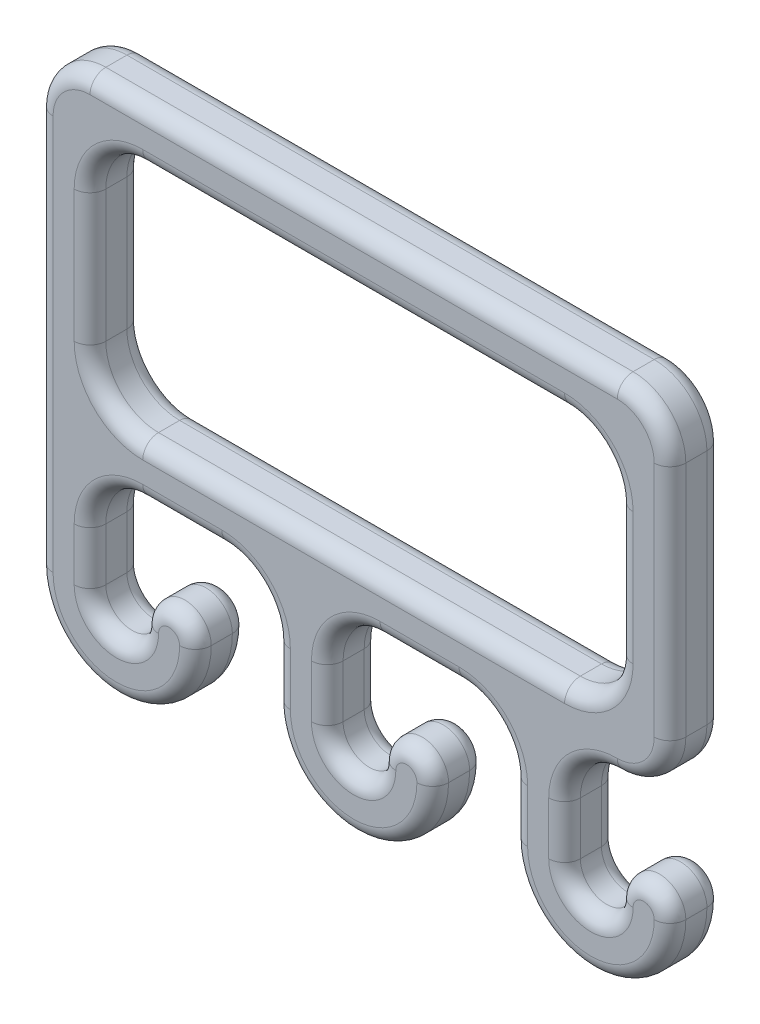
SolidWorks part; units mm, degrees
ref_plane "Plano frontal" through (0, 0, 0) normal (0, 0, 1) x (1, 0, 0)
ref_plane "Plano superior" through (0, 0, 0) normal (0, 1, 0) x (1, 0, 0)
ref_plane "Plano direito" through (0, 0, 0) normal (1, 0, 0) x (0, 0, -1)
sketch "Esboço1" plane through (0, 0, 0) normal (0, 0, 1) x (1, 0, 0)
  line L0 (-10, 55) -> (110, 55)
  line L1 (0, 0) -> (100, 0)
  line L2 (0, 0) -> (0, 45)
  line L3 (0, 45) -> (100, 45)
  line L4 (100, 0) -> (100, 45)
  line L5 (110, -10) -> (110, 55)
  line L6 (-10, -10) -> (110, -10)
  line L7 (-10, -10) -> (-10, 55)
  line B0 (-10, -10) -> (-10, -30)
  line B1 (0, -10) -> (0, -30)
  arc B2 (-10, -30) -> (20, -30) centre (5, -30) ccw
  arc B3 (0, -30) -> (10, -30) centre (5, -30) ccw
  arc B4 (20, -30) -> (10, -30) centre (15, -30) ccw
  line B5 (35, -10) -> (35, -30)
  line B6 (45, -10) -> (45, -30)
  arc B7 (35, -30) -> (65, -30) centre (50, -30) ccw
  arc B8 (45, -30) -> (55, -30) centre (50, -30) ccw
  arc B9 (65, -30) -> (55, -30) centre (60, -30) ccw
  line B10 (80, -10) -> (80, -30)
  line B11 (90, -10) -> (90, -30)
  arc B12 (80, -30) -> (110, -30) centre (95, -30) ccw
  arc B13 (90, -30) -> (100, -30) centre (95, -30) ccw
  arc B14 (110, -30) -> (100, -30) centre (105, -30) ccw
  dimension "D4" = 3
  dimension "D1" = 100
  dimension "D2" = 45
  dimension "D3" = 10
sketch_block_instance "Bloco1-1"
sketch_block "Bloco1"
sketch_block_instance "Bloco1-2"
sketch_block_instance "Bloco1-3"
extrude "Ressalto-extrusão1" add sketch "Esboço1" along normal blind 10 contours L7 L6 L5 L0 L4 L1 L2 L3 | B7 B9 B8 B6 L6 B5 | B12 B14 B13 B11 L6 B10 | B2 B4 B3 B1 L6 B0
fillet "Filete1" radius 10 12 edges at (100, 45, 5) (100, 0, 5) (0, 0, 5) (0, 45, 5) (35, -10, 5) (80, -10, 5) (90, -10, 5) (45, -10, 5) (0, -10, 5) (110, -10, 5) (110, 55, 5) (-10, 55, 5)
fillet "Filete3" radius 3 70 edges at (-7.0711, 52.0711, 10) (-7.0711, 52.0711, 0) (-10, 7.5, 10) (-10, 7.5, 0) (5, -45, 0) (5, -45, 10) (15, -25, 0) (15, -25, 10) (5, -35, 0) (5, -35, 10) (0, -25, 0) (0, -25, 10) (2.9289, -12.9289, 10) (2.9289, -12.9289, 0) (17.5, -10, 0) (17.5, -10, 10) (32.0711, -12.9289, 10) (32.0711, -12.9289, 0) (35, -25, 10) (35, -25, 0) (50, -45, 0) (50, -45, 10) (60, -25, 0) (60, -25, 10) (50, -35, 0) (50, -35, 10) (45, -25, 0) (45, -25, 10) (47.9289, -12.9289, 10) (47.9289, -12.9289, 0) (62.5, -10, 0) (62.5, -10, 10) (77.0711, -12.9289, 10) (77.0711, -12.9289, 0) (80, -25, 10) (80, -25, 0) (95, -45, 0) (95, -45, 10) (105, -25, 0) (105, -25, 10) (95, -35, 0) (95, -35, 10) (90, -25, 0) (90, -25, 10) (92.9289, -12.9289, 10) (92.9289, -12.9289, 0) (107.0711, -7.0711, 10) (107.0711, -7.0711, 0) (110, 22.5, 10) (110, 22.5, 0) (107.0711, 52.0711, 10) (107.0711, 52.0711, 0) (2.9289, 42.0711, 10) (2.9289, 42.0711, 0) (0, 22.5, 10) (0, 22.5, 0) (2.9289, 2.9289, 10) (2.9289, 2.9289, 0) (50, 0, 10) (50, 0, 0) (97.0711, 2.9289, 10) (97.0711, 2.9289, 0) (100, 22.5, 10) (100, 22.5, 0) (97.0711, 42.0711, 10) (97.0711, 42.0711, 0) (50, 55, 10) (50, 55, 0) (50, 45, 0) (50, 45, 10)
